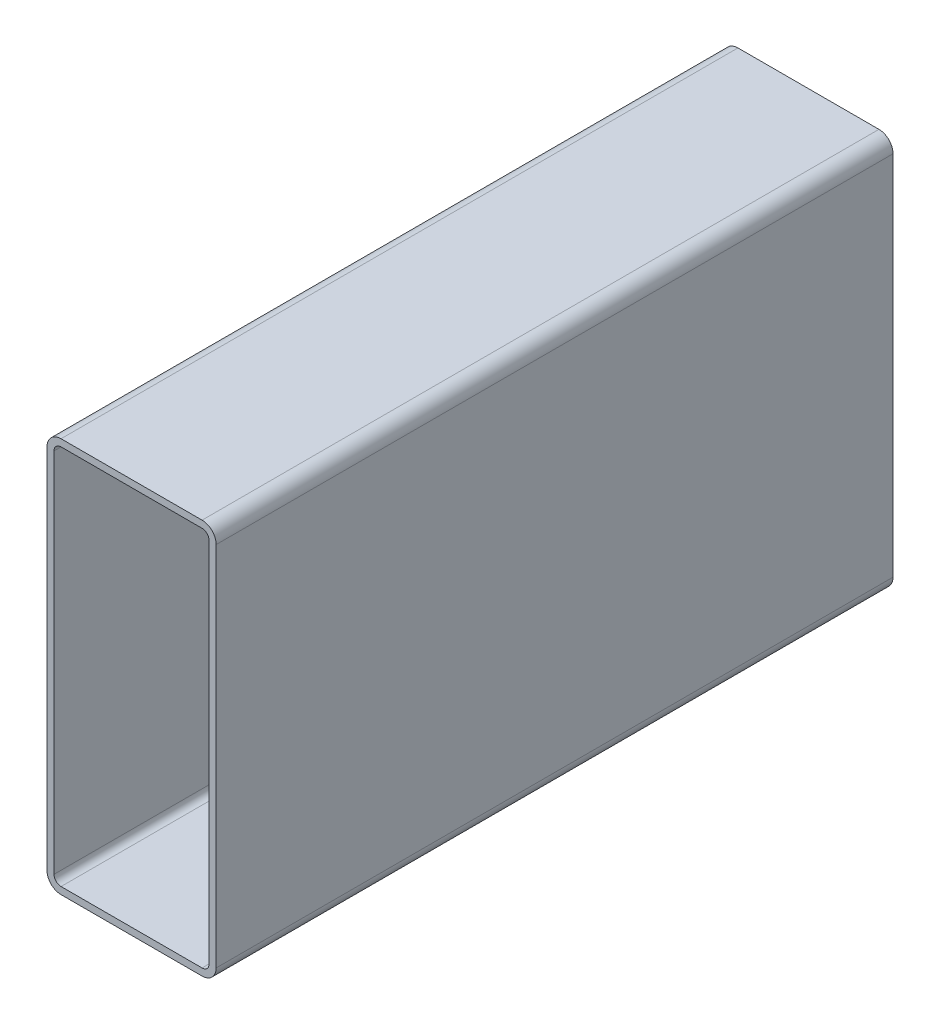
SolidWorks part; units mm, degrees
ref_plane "Front Plane" through (0, 0, 0) normal (0, 0, 1) x (1, 0, 0)
ref_plane "Top Plane" through (0, 0, 0) normal (0, 1, 0) x (1, 0, 0)
ref_plane "Right Plane" through (0, 0, 0) normal (1, 0, 0) x (0, 0, -1)
sketch "Sketch1" plane through (0, 0, 0) normal (0, 0, 1) x (1, 0, 0)
sketch_block_instance "HSS7x3x0.125-1"
sketch_block "HSS7x3x0.125"
extrude "Boss-Extrude1" add sketch "Sketch1" along normal blind 304.8
